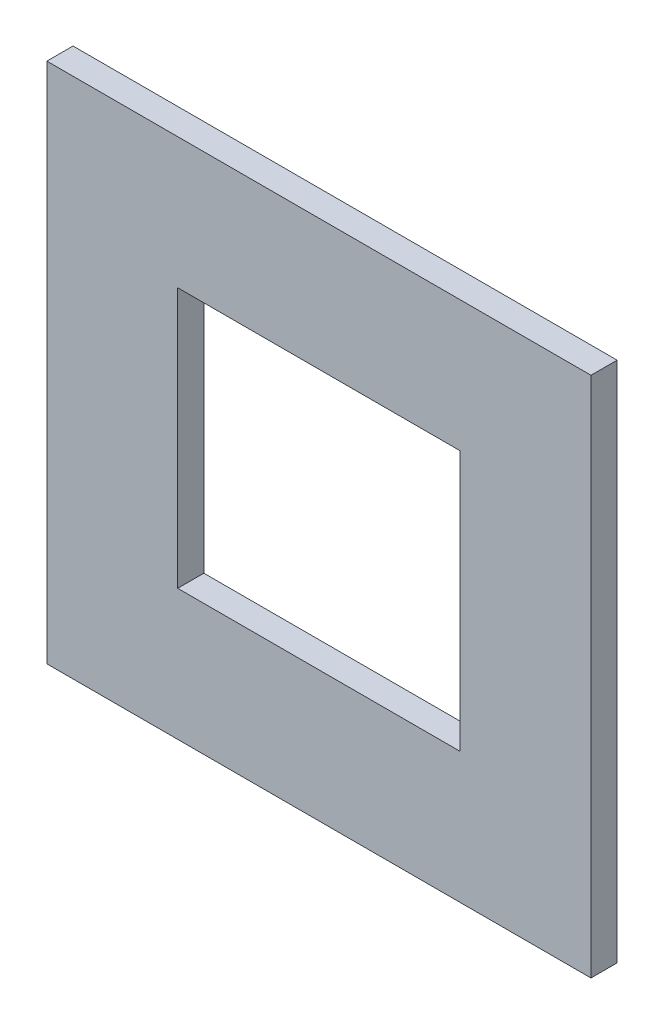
SolidWorks part; units mm, degrees
ref_plane "Front Plane" through (0, 0, 0) normal (0, 0, 1) x (1, 0, 0)
ref_plane "Top Plane" through (0, 0, 0) normal (0, 1, 0) x (1, 0, 0)
ref_plane "Right Plane" through (0, 0, 0) normal (1, 0, 0) x (0, 0, -1)
sketch "Sketch1" plane through (0, 0, 0) normal (0, 0, 1) x (1, 0, 0)
  line L1 (80.9625, -74.6125) -> (-80.9625, -74.6125)
  line L2 (80.9625, -74.6125) -> (80.9625, 74.6125)
  line L3 (80.9625, 74.6125) -> (-80.9625, 74.6125)
  line L4 (-80.9625, -74.6125) -> (-80.9625, 74.6125)
  line L5 (80.9625, -74.6125) -> (-80.9625, 74.6125) construction
  line L6 (80.9625, 74.6125) -> (-80.9625, -74.6125) construction
  line L7 (-639.1231, 371.2771) -> (768.3621, 371.2771)
  line L8 (-639.1231, 371.2771) -> (-639.1231, -757.682)
  line L9 (-639.1231, -757.682) -> (768.3621, -757.682)
  line L10 (768.3621, 371.2771) -> (768.3621, -757.682)
  point P0 (0, 0)
  dimension "D1" = 161.925
  dimension "D2" = 149.225
extrude "Boss-Extrude1" add sketch "Sketch1" along normal blind 15
sketch "Sketch2" plane through (0, 0, 0) normal (0, 0, -1) x (-1, 0, 0)
  line L0 (-80.9625, 74.6125) -> (80.9625, 74.6125) construction
  line L1 (-834.5725, 454.6118) -> (800.2783, 454.6118)
  line L2 (-834.5725, 454.6118) -> (-834.5725, -959.418)
  line L3 (-834.5725, -959.418) -> (800.2783, -959.418)
  line L4 (800.2783, 454.6118) -> (800.2783, -959.418)
  line L5 (-155.9687, 149.6187) -> (155.9687, 149.6187)
  line L6 (-155.9687, 149.6187) -> (-155.9687, -149.6187)
  line L7 (-155.9687, -149.6187) -> (155.9687, -149.6187)
  line L8 (155.9687, 149.6187) -> (155.9687, -149.6187)
  line L9 (80.9625, 74.6125) -> (80.9625, -74.6125) construction
  line L10 (80.9625, -74.6125) -> (-80.9625, -74.6125) construction
  line L11 (-80.9625, -74.6125) -> (-80.9625, 74.6125) construction
  dimension "D1" = 75.0062
  dimension "D2" = 75.0062
  dimension "D3" = 75.0062
  dimension "D4" = 75.0062
extrude "Cut-Extrude1" cut sketch "Sketch2" against normal through all
